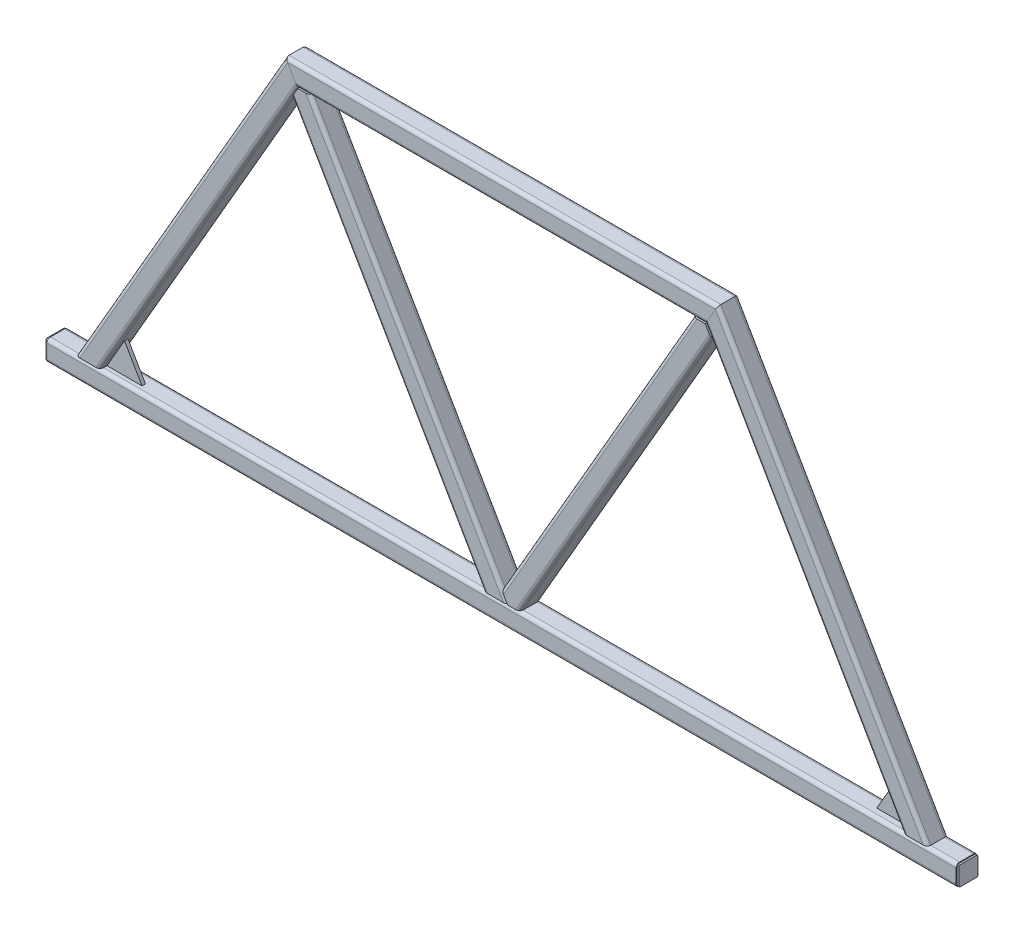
SolidWorks part; units mm, degrees
ref_plane "Front Plane" through (0, 0, 0) normal (0, 0, 1) x (1, 0, 0)
ref_plane "Top Plane" through (0, 0, 0) normal (0, 1, 0) x (1, 0, 0)
ref_plane "Right Plane" through (0, 0, 0) normal (1, 0, 0) x (0, 0, -1)
sketch "Sketch 01" plane through (0, 0, 0) normal (0, 0, 1) x (1, 0, 0)
  line L0 (-1651, 0) -> (1651, 0)
  dimension "D1" = 3302
  dimension "D2" = 1651
sketch "Sketch 02" plane through (0, 0, 0) normal (0, 0, 1) x (1, 0, 0)
  line L2 (-762, 1319.8227) -> (762, 1319.8227)
  line L3 (-762, 1319.8227) -> (-1524, 0)
  line L4 (0, 0) -> (0, 1860.1275) construction
  line L7 (-1651, 0) -> (1651, 0) construction
  line L9 (762, 1319.8227) -> (1524, 0)
  dimension "D1" = 60
  dimension "D2" = 1524
  dimension "D3" = 762
  dimension "D4" = 1524
  dimension "D5" = 1524
sketch "Sketch121" plane through (0, 0, 0) normal (0, 0, 1) x (1, 0, 0)
  line L0 (-762, 1319.8227) -> (0, 0)
  line L1 (-1651, 0) -> (1651, 0) construction
  line L2 (0, 0) -> (762, 1319.8227)
other "Structural Member1"
ref_plane "Plane1" through (-1651, 0, 0) normal (1, 0, 0) x (0, 1, 0)
sketch "Sketch1" plane through (-1651, 0, 0) normal (1, 0, 0) x (0, 1, 0)
  line L0 (-25.4, -31.75) -> (25.4, -31.75)
  line L1 (-31.75, -25.4) -> (-31.75, 25.4)
  line L2 (25.4, 31.75) -> (-25.4, 31.75)
  line L3 (31.75, 25.4) -> (31.75, -25.4)
  line L4 (-25.4, -38.1) -> (25.4, -38.1)
  line L5 (-38.1, -25.4) -> (-38.1, 25.4)
  line L6 (25.4, 38.1) -> (-25.4, 38.1)
  line L7 (38.1, 25.4) -> (38.1, -25.4)
  line L8 (0, 0) -> (31.75, 0) construction
  line L9 (0, 0) -> (0, 31.75) construction
  arc A0 (38.1, 25.4) -> (25.4, 38.1) centre (25.4, 25.4) ccw
  arc A1 (25.4, -38.1) -> (38.1, -25.4) centre (25.4, -25.4) ccw
  arc A2 (-38.1, -25.4) -> (-25.4, -38.1) centre (-25.4, -25.4) ccw
  arc A3 (-25.4, 38.1) -> (-38.1, 25.4) centre (-25.4, 25.4) ccw
  arc A4 (-25.4, 31.75) -> (-31.75, 25.4) centre (-25.4, 25.4) ccw
  arc A5 (31.75, 25.4) -> (25.4, 31.75) centre (25.4, 25.4) ccw
  arc A6 (25.4, -31.75) -> (31.75, -25.4) centre (25.4, -25.4) ccw
  arc A7 (-31.75, -25.4) -> (-25.4, -31.75) centre (-25.4, -25.4) ccw
  point P3 (0, 38.1)
  point P4 (38.1, 0)
  point P5 (0, -38.1)
  point P6 (-38.1, 0)
  point P7 (-38.1, 38.1)
  point P8 (-38.1, -38.1)
  point P33 (0, 0)
  point P35 (38.1, -38.1)
  point P36 (38.1, 38.1)
  point P37 (0, 0)
  dimension "D1" = 12.7
  dimension "Thickness" = 6.35
  dimension "V_leg" = 76.2
other "Structural Member2"
ref_plane "Plane2" through (-762, 1319.8227, 0) normal (1, 0, 0) x (0, 1, 0)
sketch "Sketch18" plane through (-762, 1319.8227, 0) normal (1, 0, 0) x (0, 1, 0)
  line L0 (-25.4, -31.75) -> (25.4, -31.75)
  line L1 (-31.75, -25.4) -> (-31.75, 25.4)
  line L2 (25.4, 31.75) -> (-25.4, 31.75)
  line L3 (31.75, 25.4) -> (31.75, -25.4)
  line L4 (-25.4, -38.1) -> (25.4, -38.1)
  line L5 (-38.1, -25.4) -> (-38.1, 25.4)
  line L6 (25.4, 38.1) -> (-25.4, 38.1)
  line L7 (38.1, 25.4) -> (38.1, -25.4)
  line L8 (0, 0) -> (31.75, 0) construction
  line L9 (0, 0) -> (0, 31.75) construction
  arc A0 (38.1, 25.4) -> (25.4, 38.1) centre (25.4, 25.4) ccw
  arc A1 (25.4, -38.1) -> (38.1, -25.4) centre (25.4, -25.4) ccw
  arc A2 (-38.1, -25.4) -> (-25.4, -38.1) centre (-25.4, -25.4) ccw
  arc A3 (-25.4, 38.1) -> (-38.1, 25.4) centre (-25.4, 25.4) ccw
  arc A4 (-25.4, 31.75) -> (-31.75, 25.4) centre (-25.4, 25.4) ccw
  arc A5 (31.75, 25.4) -> (25.4, 31.75) centre (25.4, 25.4) ccw
  arc A6 (25.4, -31.75) -> (31.75, -25.4) centre (25.4, -25.4) ccw
  arc A7 (-31.75, -25.4) -> (-25.4, -31.75) centre (-25.4, -25.4) ccw
  point P3 (0, 38.1)
  point P4 (38.1, 0)
  point P5 (0, -38.1)
  point P6 (-38.1, 0)
  point P7 (-38.1, 38.1)
  point P8 (-38.1, -38.1)
  point P33 (0, 0)
  point P35 (38.1, -38.1)
  point P36 (38.1, 38.1)
  point P37 (0, 0)
  dimension "D1" = 12.7
  dimension "Thickness" = 6.35
  dimension "V_leg" = 76.2
other "Structural Member3"
ref_plane "Plane6" through (-762, 1319.8227, 0) normal (0.5, -0.866, 0) x (0.866, 0.5, 0)
sketch "Sketch122" plane through (-762, 1319.8227, 0) normal (0.5, -0.866, 0) x (0.866, 0.5, 0)
  line L0 (-25.4, -31.75) -> (25.4, -31.75)
  line L1 (-31.75, -25.4) -> (-31.75, 25.4)
  line L2 (25.4, 31.75) -> (-25.4, 31.75)
  line L3 (31.75, 25.4) -> (31.75, -25.4)
  line L4 (-25.4, -38.1) -> (25.4, -38.1)
  line L5 (-38.1, -25.4) -> (-38.1, 25.4)
  line L6 (25.4, 38.1) -> (-25.4, 38.1)
  line L7 (38.1, 25.4) -> (38.1, -25.4)
  line L8 (0, 0) -> (31.75, 0) construction
  line L9 (0, 0) -> (0, 31.75) construction
  arc A0 (38.1, 25.4) -> (25.4, 38.1) centre (25.4, 25.4) ccw
  arc A1 (25.4, -38.1) -> (38.1, -25.4) centre (25.4, -25.4) ccw
  arc A2 (-38.1, -25.4) -> (-25.4, -38.1) centre (-25.4, -25.4) ccw
  arc A3 (-25.4, 38.1) -> (-38.1, 25.4) centre (-25.4, 25.4) ccw
  arc A4 (-25.4, 31.75) -> (-31.75, 25.4) centre (-25.4, 25.4) ccw
  arc A5 (31.75, 25.4) -> (25.4, 31.75) centre (25.4, 25.4) ccw
  arc A6 (25.4, -31.75) -> (31.75, -25.4) centre (25.4, -25.4) ccw
  arc A7 (-31.75, -25.4) -> (-25.4, -31.75) centre (-25.4, -25.4) ccw
  point P3 (0, 38.1)
  point P4 (38.1, 0)
  point P5 (0, -38.1)
  point P6 (-38.1, 0)
  point P7 (-38.1, 38.1)
  point P8 (-38.1, -38.1)
  point P33 (0, 0)
  point P35 (38.1, -38.1)
  point P36 (38.1, 38.1)
  point P37 (0, 0)
  dimension "D1" = 12.7
  dimension "Thickness" = 6.35
  dimension "V_leg" = 76.2
other "Structural Member4"
ref_plane "Plane7" through (0, 0, 0) normal (0.5, 0.866, 0) x (-0.866, 0.5, 0)
sketch "Sketch123" plane through (0, 0, 0) normal (0.5, 0.866, 0) x (-0.866, 0.5, 0)
  line L0 (-25.4, -31.75) -> (25.4, -31.75)
  line L1 (-31.75, -25.4) -> (-31.75, 25.4)
  line L2 (25.4, 31.75) -> (-25.4, 31.75)
  line L3 (31.75, 25.4) -> (31.75, -25.4)
  line L4 (-25.4, -38.1) -> (25.4, -38.1)
  line L5 (-38.1, -25.4) -> (-38.1, 25.4)
  line L6 (25.4, 38.1) -> (-25.4, 38.1)
  line L7 (38.1, 25.4) -> (38.1, -25.4)
  line L8 (0, 0) -> (31.75, 0) construction
  line L9 (0, 0) -> (0, 31.75) construction
  arc A0 (38.1, 25.4) -> (25.4, 38.1) centre (25.4, 25.4) ccw
  arc A1 (25.4, -38.1) -> (38.1, -25.4) centre (25.4, -25.4) ccw
  arc A2 (-38.1, -25.4) -> (-25.4, -38.1) centre (-25.4, -25.4) ccw
  arc A3 (-25.4, 38.1) -> (-38.1, 25.4) centre (-25.4, 25.4) ccw
  arc A4 (-25.4, 31.75) -> (-31.75, 25.4) centre (-25.4, 25.4) ccw
  arc A5 (31.75, 25.4) -> (25.4, 31.75) centre (25.4, 25.4) ccw
  arc A6 (25.4, -31.75) -> (31.75, -25.4) centre (25.4, -25.4) ccw
  arc A7 (-31.75, -25.4) -> (-25.4, -31.75) centre (-25.4, -25.4) ccw
  point P3 (0, 38.1)
  point P4 (38.1, 0)
  point P5 (0, -38.1)
  point P6 (-38.1, 0)
  point P7 (-38.1, 38.1)
  point P8 (-38.1, -38.1)
  point P33 (0, 0)
  point P35 (38.1, -38.1)
  point P36 (38.1, 38.1)
  point P37 (0, 0)
  dimension "D1" = 12.7
  dimension "Thickness" = 6.35
  dimension "V_leg" = 76.2
other "Trim/Extend14"
other "Trim/Extend15"
other "Trim/Extend16"
other "Trim/Extend17"
other "Trim/Extend20"
other "Trim/Extend21"
other "Trim/Extend13"
other "Trim/Extend9"
other "Trim/Extend10"
other "End cap1" parameters "D1"=6.35, "D2"=3.175, "D3"=3.175
other "End cap2" parameters "D1"=6.35, "D2"=3.175, "D3"=3.175
other "Gusset1" parameters "D1"=12.7, "D2"=6.35, "D3"=0, "D4"=0, "D10"=6.35, "D11"=127, "D12"=127, "D13"=12.7, "D14"=45, "D15"=12.7, "D16"=50.8, "D17"=50.8, "D18"=60
sketch "Sketch124" plane through (-1458.0089, 38.1, 0) normal (0, 0, 1) x (1, 0, 0)
  line L0 (0, 0) -> (63.5, 109.9852)
  line L1 (0, 0) -> (127, 0)
  line L2 (63.5, 109.9852) -> (127, 0)
other "Gusset2" parameters "D1"=12.7, "D2"=12.7, "D3"=0, "D4"=0, "D10"=6.35, "D11"=127, "D12"=127, "D13"=12.7, "D14"=45, "D15"=12.7
sketch "Sketch125" plane through (1458.0089, 38.1, 0) normal (0, 0, 1) x (1, 0, 0)
  line L0 (0, 0) -> (-63.5, 109.9852)
  line L1 (0, 0) -> (-127, 0)
  line L2 (-63.5, 109.9852) -> (-127, 0)
